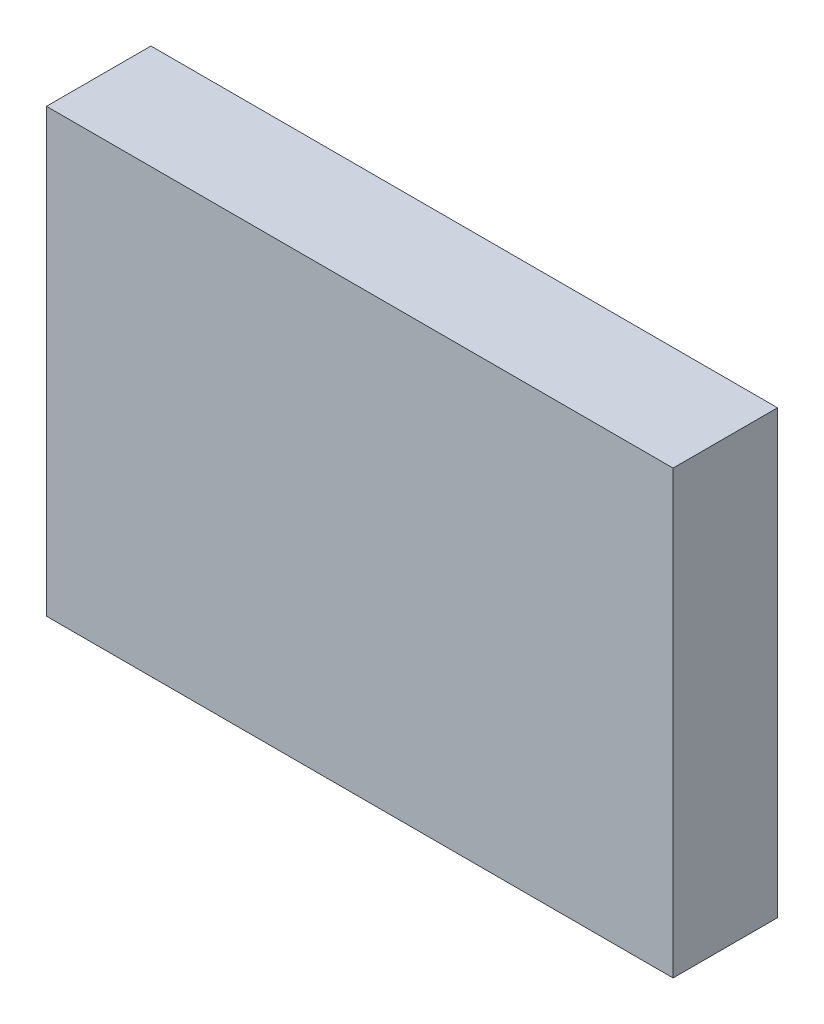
SolidWorks part; units mm, degrees
ref_plane "Plan de face" through (0, 0, 0) normal (0, 0, 1) x (1, 0, 0)
ref_plane "Plan de dessus" through (0, 0, 0) normal (0, 1, 0) x (1, 0, 0)
ref_plane "Plan de droite" through (0, 0, 0) normal (1, 0, 0) x (0, 0, -1)
sketch "Esquisse1" plane through (0, 0, 0) normal (0, 0, 1) x (1, 0, 0)
  line L1 (0, 0) -> (210, 0)
  line L2 (0, 0) -> (0, 148)
  line L3 (0, 148) -> (210, 148)
  line L4 (210, 0) -> (210, 148)
  dimension "D1" = 148
  dimension "D2" = 210
extrude "Boss.-Extru.1" add sketch "Esquisse1" along normal blind 35
